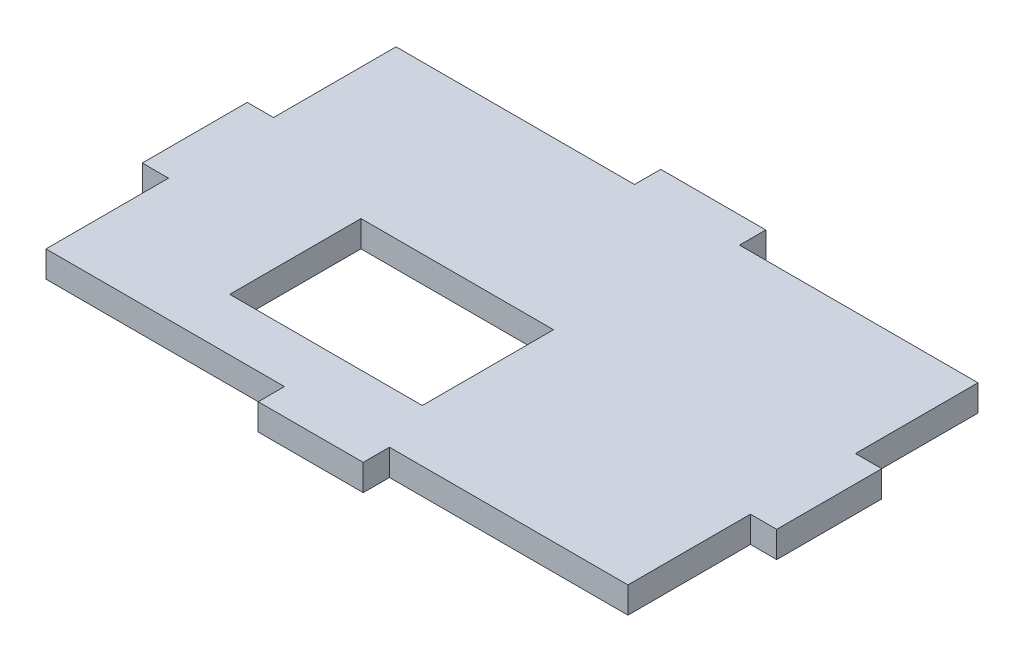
SolidWorks part; units mm, degrees
ref_plane "Front Plane" through (0, 0, 0) normal (0, 0, 1) x (1, 0, 0)
ref_plane "Top Plane" through (0, 0, 0) normal (0, 1, 0) x (1, 0, 0)
ref_plane "Right Plane" through (0, 0, 0) normal (1, 0, 0) x (0, 0, -1)
sketch "Sketch1" plane through (0, 0, 0) normal (0, 1, 0) x (1, 0, 0)
  line L0 (33.25, 0) -> (33.25, -40) construction
  line L1 (0, 0) -> (66.5, 0)
  line L2 (0, 0) -> (0, -40)
  line L3 (0, -40) -> (66.5, -40)
  line L4 (66.5, 0) -> (66.5, -40)
  line L5 (0, -20) -> (66.5, -20) construction
  line L6 (39.25, -40) -> (39.25, -43)
  line L7 (27.25, 0) -> (39.25, 0)
  line L8 (27.25, 0) -> (27.25, 3)
  line L9 (27.25, 3) -> (39.25, 3)
  line L10 (39.25, 0) -> (39.25, 3)
  line L11 (0, -14) -> (-3, -14)
  line L12 (0, -14) -> (0, -26)
  line L13 (0, -26) -> (-3, -26)
  line L14 (-3, -14) -> (-3, -26)
  line L15 (27.25, -43) -> (39.25, -43)
  line L16 (27.25, -40) -> (27.25, -43)
  line L17 (27.25, -40) -> (39.25, -40)
  line L18 (69.5, -14) -> (69.5, -26)
  line L19 (66.5, -26) -> (69.5, -26)
  line L20 (66.5, -14) -> (66.5, -26)
  line L21 (66.5, -14) -> (69.5, -14)
  dimension "D1" = 66.5
  dimension "D2" = 40
  dimension "D3" = 12
  dimension "D4" = 6
  dimension "D5" = 3
  dimension "D6" = 3
  dimension "D7" = 12
  dimension "D8" = 6
extrude "Boss-Extrude1" add sketch "Sketch1" along normal blind 3 contours L4 L1 L2 L3 | L3 L16 L15 L6 | L11 L14 L13 L2 | L1 L10 L9 L8 | L21 L4 L19 L18
sketch "Sketch2" plane through (0, 3, 0) normal (0, 1, 0) x (1, 0, 0)
  line L0 (0, -40) -> (27.25, -40) construction
  line L1 (14.9959, -19) -> (36.9959, -19)
  line L2 (14.9959, -19) -> (14.9959, -34)
  line L3 (14.9959, -34) -> (36.9959, -34)
  line L4 (36.9959, -19) -> (36.9959, -34)
  dimension "D1" = 22
  dimension "D2" = 15
  dimension "D3" = 6
extrude "Cut-Extrude1" cut sketch "Sketch2" against normal blind 3
